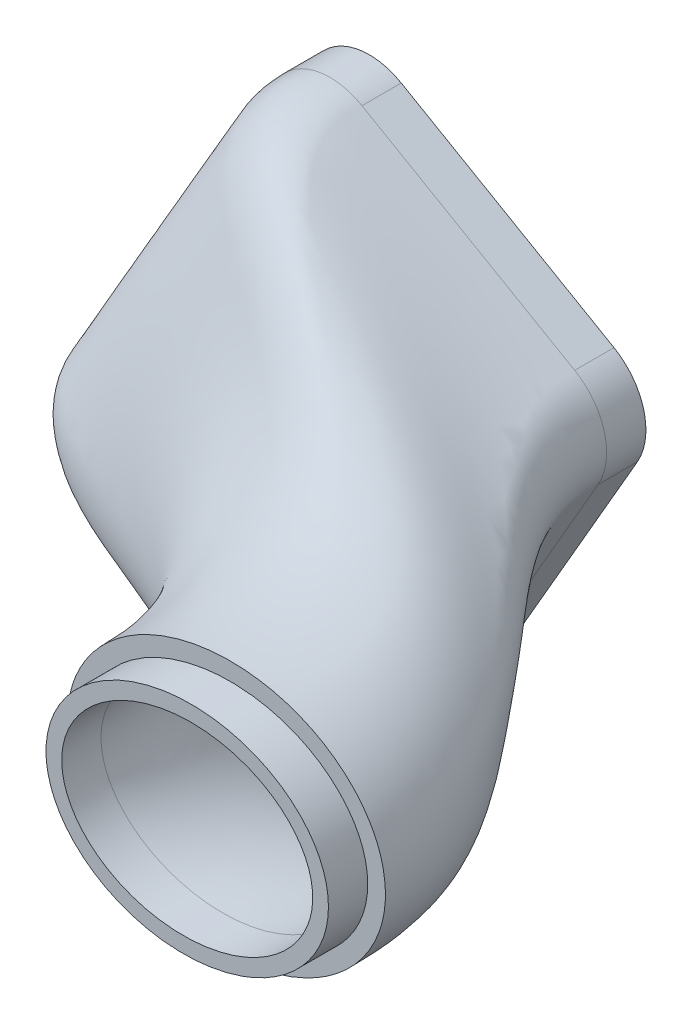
SolidWorks part; units mm, degrees
other "<NADMUCH-PRAWY>-<Sfazowanie1>"
ref_plane "Płaszczyzna przednia" through (0, 0, 0) normal (0, 0, 1) x (1, 0, 0)
ref_plane "Płaszczyzna górna" through (0, 0, 0) normal (0, 1, 0) x (1, 0, 0)
ref_plane "Płaszczyzna prawa" through (0, 0, 0) normal (1, 0, 0) x (0, 0, -1)
sketch "Szkic5-NADMUCH-PRAWY_Odbicie lustrzane" plane through (0, 0, 44) normal (0, 0, 1) x (1, 0, 0)
  ellipse E1 centre (-38.8831, 36.4011) end of major axis (-46.9612, 35.9523) minor radius 6.4945
  point P13 (-46.0626, 36.0022)
  point P14 (-45.2638, 36.0466)
  dimension "D1" = 0.9
  dimension "D2" = 1.7
sketch "Szkic6-NADMUCH-PRAWY_Odbicie lustrzane" plane through (0, 0, 24) normal (0, 0, -1) x (-1, 0, 0)
  line L4 (62.241, 32.9673) -> (51.4157, 26.7173)
  line L5 (51.0742, 26.8088) -> (42.5742, 41.5312)
  line L6 (42.6657, 41.8727) -> (53.491, 48.1227)
  line L7 (53.8325, 48.0312) -> (62.3325, 33.3088)
  line L8 (63.741, 30.3692) -> (52.9157, 24.1192)
  line L9 (48.4761, 25.3088) -> (39.9761, 40.0312)
  line L10 (41.1657, 44.4708) -> (51.991, 50.7208)
  line L11 (56.4306, 49.5312) -> (64.9306, 34.8088)
  line L12 (54.6985, 48.5312) -> (63.1985, 33.8088)
  line L13 (62.741, 32.1013) -> (51.9157, 25.8513)
  line L14 (50.2082, 26.3088) -> (41.7082, 41.0312)
  line L15 (42.1657, 42.7388) -> (52.991, 48.9888)
  arc A3 (51.0742, 26.8088) -> (51.4157, 26.7173) centre (51.2907, 26.9338) ccw
  arc A4 (42.6657, 41.8727) -> (42.5742, 41.5312) centre (42.7907, 41.6562) ccw
  arc A5 (53.8325, 48.0312) -> (53.491, 48.1227) centre (53.616, 47.9062) ccw
  arc A7 (62.241, 32.9673) -> (62.3325, 33.3088) centre (62.116, 33.1838) ccw
  arc A8 (48.4761, 25.3088) -> (52.9157, 24.1192) centre (51.2907, 26.9338) ccw
  arc A9 (41.1657, 44.4708) -> (39.9761, 40.0312) centre (42.7907, 41.6562) ccw
  arc A10 (56.4306, 49.5312) -> (51.991, 50.7208) centre (53.616, 47.9062) ccw
  arc A11 (63.741, 30.3692) -> (64.9306, 34.8088) centre (62.116, 33.1838) ccw
  arc A12 (62.741, 32.1013) -> (63.1985, 33.8088) centre (62.116, 33.1838) ccw
  arc A13 (50.2082, 26.3088) -> (51.9157, 25.8513) centre (51.2907, 26.9338) ccw
  arc A14 (42.1657, 42.7388) -> (41.7082, 41.0312) centre (42.7907, 41.6562) ccw
  arc A15 (54.6985, 48.5312) -> (52.991, 48.9888) centre (53.616, 47.9062) ccw
  dimension "D1" = 13
  dimension "D2" = 3
  dimension "D3" = 1
sketch "Szkic7-NADMUCH-PRAWY_Odbicie lustrzane" plane through (0, 0, 44) normal (0, 0, -1) x (-1, 0, 0)
  spline S2 degree 3 poles (44.8929, 34.3412) (45.4015, 36.039) (45.0841, 37.7826) (43.8573, 39.4712) (41.7698, 40.7588) (39.1569, 41.3297) (36.4968, 41.0517) (34.2796, 40.0033) (32.8733, 38.4611) (32.3646, 36.7633) (32.682, 35.0197) (33.9088, 33.3311) (35.9963, 32.0435) (38.6092, 31.4725) (41.2693, 31.7505) (43.4866, 32.7989) (44.8929, 34.3412) (45.4015, 36.039) (45.0841, 37.7826) knots -1.178097 -0.785398 -0.392699 0 0.392699 0.785398 1.178097 1.570796 1.963495 2.356194 2.748894 3.141593 3.534292 3.926991 4.31969 4.712389 5.105088 5.497787 5.890486 6.283185 6.675884 7.068583 7.461283 only from (45.2638, 36.0466) to (45.2638, 36.0466)
  spline S3 degree 3 poles (45.6017, 33.9122) (46.2344, 35.9927) (45.8361, 38.1305) (44.3975, 40.0871) (42.0647, 41.5178) (39.202, 42.1414) (36.2878, 41.8388) (33.8109, 40.6753) (32.1644, 38.8901) (31.5317, 36.8096) (31.9301, 34.6718) (33.3686, 32.7151) (35.7014, 31.2844) (38.5641, 30.6609) (41.4783, 30.9635) (43.9552, 32.1269) (45.6017, 33.9122) (46.2344, 35.9927) (45.8361, 38.1305) knots -1.178097 -0.785398 -0.392699 0 0.392699 0.785398 1.178097 1.570796 1.963495 2.356194 2.748894 3.141593 3.534292 3.926991 4.31969 4.712389 5.105088 5.497787 5.890486 6.283185 6.675884 7.068583 7.461283 only from (46.0626, 36.0022) to (46.0626, 36.0022)
sketch "Szkic8-NADMUCH-PRAWY_Odbicie lustrzane" plane through (0, 0, 24) normal (0, 0, 1) x (1, 0, 0)
  line L8 (-48.4761, 25.3088) -> (-39.9761, 40.0312)
  line L9 (-41.1657, 44.4708) -> (-51.991, 50.7208)
  line L10 (-56.4306, 49.5312) -> (-64.9306, 34.8088)
  line L11 (-63.741, 30.3692) -> (-52.9157, 24.1192)
  line L12 (-42.1657, 42.7388) -> (-52.991, 48.9888)
  line L13 (-54.6985, 48.5312) -> (-63.1985, 33.8088)
  line L14 (-62.741, 32.1013) -> (-51.9157, 25.8513)
  line L15 (-50.2082, 26.3088) -> (-41.7082, 41.0312)
  arc A8 (-52.9157, 24.1192) -> (-48.4761, 25.3088) centre (-51.2907, 26.9338) ccw
  arc A9 (-39.9761, 40.0312) -> (-41.1657, 44.4708) centre (-42.7907, 41.6562) ccw
  arc A10 (-51.991, 50.7208) -> (-56.4306, 49.5312) centre (-53.616, 47.9062) ccw
  arc A11 (-64.9306, 34.8088) -> (-63.741, 30.3692) centre (-62.116, 33.1838) ccw
  arc A12 (-52.991, 48.9888) -> (-54.6985, 48.5312) centre (-53.616, 47.9062) ccw
  arc A13 (-63.1985, 33.8088) -> (-62.741, 32.1013) centre (-62.116, 33.1838) ccw
  arc A14 (-51.9157, 25.8513) -> (-50.2082, 26.3088) centre (-51.2907, 26.9338) ccw
  arc A15 (-41.7082, 41.0312) -> (-42.1657, 42.7388) centre (-42.7907, 41.6562) ccw
mirrored part "NADMUCH-PRAWY_Odbicie lustrzane"
